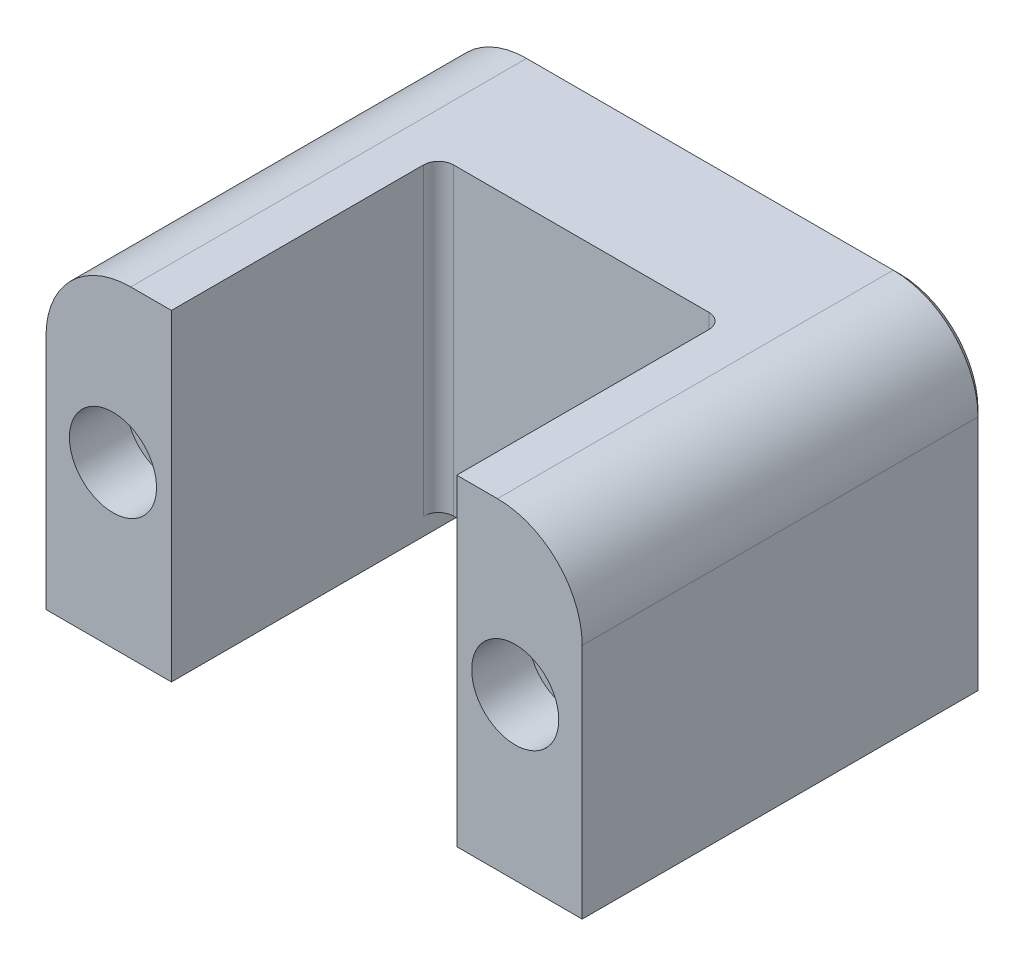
SolidWorks part; units mm, degrees
ref_plane "Front Plane" through (0, 0, 0) normal (0, 0, 1) x (1, 0, 0)
ref_plane "Top Plane" through (0, 0, 0) normal (0, 1, 0) x (1, 0, 0)
ref_plane "Right Plane" through (0, 0, 0) normal (1, 0, 0) x (0, 0, -1)
sketch "Sketch1" plane through (0, 0, 0) normal (0, 1, 0) x (1, 0, 0)
  line L0 (-55, 0) -> (55, 0) construction
  line L1 (-31.7436, 0) -> (-16.891, 0)
  line L2 (-31.7436, 0) -> (-31.7436, 47.625)
  line L3 (-31.7436, 47.625) -> (31.7436, 47.625)
  line L4 (31.7436, 0) -> (31.7436, 47.625)
  line L5 (0, -55) -> (0, 55) construction
  line L6 (16.891, 0) -> (31.7436, 0)
  line L8 (-16.891, 0) -> (-16.891, 31.623)
  line L9 (-16.891, 31.623) -> (16.891, 31.623)
  line L10 (16.891, 0) -> (16.891, 31.623)
  dimension "D1" = 63.4873
  dimension "D2" = 47.625
  dimension "D3" = 31.7436
  dimension "D4" = 33.782
  dimension "D5" = 31.623
  dimension "D6" = 16.891
extrude "Extrude1" add sketch "Sketch1" along normal blind 38.1
sketch "Sketch3" plane through (0, 0, 0) normal (0, -1, 0) x (1, 0, 0)
  line L0 (16.891, -31.623) -> (16.891, 0) construction
  line L1 (-16.891, -40.513) -> (16.891, -40.513)
  line L2 (-16.891, -40.513) -> (-16.891, -28.7429)
  line L3 (-16.891, -28.7429) -> (16.891, -28.7429)
  line L4 (16.891, -40.513) -> (16.891, -28.7429)
  line L5 (20.955, 0) -> (-20.955, 0) construction
  line L6 (-16.891, 0) -> (-16.891, -31.623) construction
  dimension "D1" = 40.513
  dimension "D2" = 11.7701
extrude "Cut-Extrude2" cut sketch "Sketch3" against normal blind 2.0828
fillet "Fillet3" radius 2.032 2 edges at (16.891, 1.0414, -40.513) (-16.891, 1.0414, -40.513)
fillet "Fillet4" radius 1.778 2 edges at (16.891, 20.0914, -31.623) (-16.891, 20.0914, -31.623)
ref_plane "Plane1" through (0, 19.05, 0) normal (0, 1, 0) x (-1, 0, 0)
sketch "Sketch4" plane through (0, 19.05, 0) normal (0, 1, 0) x (-1, 0, 0)
  line L0 (23.8125, -47.625) -> (23.8125, 0)
  line L2 (23.8125, 0) -> (18.6563, 0)
  line L4 (18.6563, 0) -> (18.6563, -6.7564)
  line L5 (18.6563, -6.7564) -> (20.2438, -6.7564)
  line L7 (20.2438, -6.7564) -> (20.2438, -47.625)
  line L8 (20.2438, -47.625) -> (23.8125, -47.625)
  line L9 (23.8125, -4.7498) -> (23.8125, 6.5086) construction
  line L10 (23.8125, 6.5086) -> (23.8125, -40.8278) construction
  line L12 (20.955, 0) -> (-20.955, 0) construction
  line L13 (31.7436, 0) -> (16.891, 0) construction
  line L14 (-31.7436, -47.625) -> (31.7436, -47.625) construction
  line L15 (0, 20.955) -> (0, -20.955) construction
  dimension "D1" = 10.3124
  dimension "D2" = 7.1374
  dimension "D3" = 6.7564
  dimension "D4" = 23.8125
revolve "Cut-Revolve9" cut sketch "Sketch4" angle 360 about L9
mirror "Mirror1" about plane through (0, 0, 0) normal (1, 0, 0) of "Cut-Revolve9"
fillet "Fillet5" radius 10.033 2 edges at (31.7436, 38.1, -23.8125) (-31.7436, 38.1, -23.8125)
chamfer "Chamfer1" distance 0.762 angle 45 5 edges at (31.7436, 14.0335, -47.625) (-31.7436, 14.0335, -47.625) (28.8051, 35.1614, -47.625) (-28.8051, 35.1614, -47.625) (0, 38.1, -47.625)
